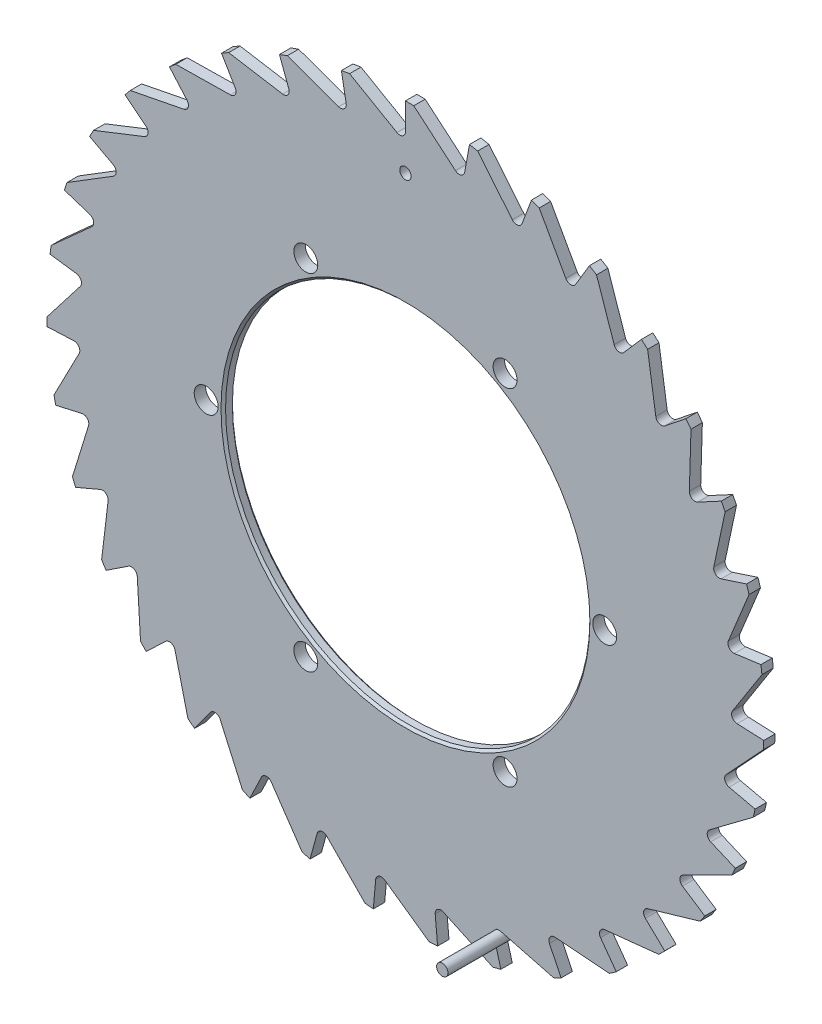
SolidWorks part; units mm, degrees
ref_plane "Plan de face" through (0, 0, 0) normal (0, 0, 1) x (1, 0, 0)
ref_plane "Plan de dessus" through (0, 0, 0) normal (0, 1, 0) x (1, 0, 0)
ref_plane "Plan de droite" through (0, 0, 0) normal (1, 0, 0) x (0, 0, -1)
sketch "Esquisse1" plane through (0, 0, 0) normal (0, 0, 1) x (1, 0, 0)
  circle A0 centre (0, 0) radius 16
  circle A1 centre (0, 0) radius 31.5
  dimension "D1" = 32
  dimension "D2" = 63
extrude "Extrusion1" add sketch "Esquisse1" along normal blind 1
chamfer "Chanfrein1" distance 0.2 angle 45 2 edges at (16, 0, 0) (16, 0, 1)
sketch "Esquisse4" plane through (0, 0, 1) normal (0, 0, 1) x (1, 0, 0)
  line L0 (0, 36.2291) -> (0, 29.15)
  line L1 (-0.75, 28.717) -> (-13.7613, 36.2291)
  line L2 (-13.7613, 36.2291) -> (0, 36.2291)
  arc A0 (0, 29.15) -> (-0.75, 28.717) centre (-0.5, 29.15) cw
  dimension "D1" = 0.5
  dimension "D2" = 60
  dimension "D3" = 29.15
extrude "Enlèv. mat.-Extru.1" cut sketch "Esquisse4" against normal through all
pattern_circular "Répétition circulaire1" count 35 over 360 about axis through (0, 0, 0) along (0, 0, 1) of "Enlèv. mat.-Extru.1"
hole_wizard "Diamètre du perçage M2.1 (2.1)1" positions "Esquisse7" profile "Esquisse6" hole size "M2.1" standard "Ansi Métrique"
sketch "Esquisse7" plane through (0, 0, 1) normal (0, 0, 1) x (1, 0, 0)
  line L1 (0, 0) -> (-38.3683, 0) construction
  circle A0 centre (0, 0) radius 16.2 construction
  point P0 (-17.5, 0)
  dimension "D1" = 17.5
sketch "Esquisse6" plane through (-17.5, 0, 1) normal (1, 0, 0) x (0, -1, 0)
  line L0 (0, 0) -> (0, 1)
  line L1 (0, 1) -> (1.05, 1)
  line L2 (1.05, 1) -> (1.05, 0)
  line L5 (1.05, 0) -> (0, 0)
  line L11 (0, -6.35) -> (0, 107.95) construction
  dimension "Diamètre du perçage jusqu'au prochain" = 2.1
  dimension "Profondeur du perçage jusqu'au prochain" = 1
pattern_circular "Répétition circulaire2" count 6 over 360 about axis through (0, 0, 0) along (0, 0, 1) of "Diamètre du perçage M2.1 (2.1)1"
sketch "Esquisse8" plane through (0, 0, 1) normal (0, 0, 1) x (1, 0, 0)
  circle A0 centre (0, 0) radius 22.3639
sketch "Esquisse10" plane through (0, 0, 1) normal (0, 0, 1) x (1, 0, 0)
  line L0 (0, 29.15) -> (0, 31.5) construction
  circle A0 centre (0, 26) radius 0.5
  circle A1 centre (0, 0) radius 16.2 construction
  dimension "D1" = 1
  dimension "D2" = 26
extrude "Enlèv. mat.-Extru.2" cut sketch "Esquisse10" against normal through all
sketch "Esquisse14" plane through (0, 0, 1) normal (0, 0, 1) x (1, 0, 0)
  circle A0 centre (8.237, -27.9665) radius 0.5
  arc A1 (8.3627, -27.4826) -> (7.755, -28.0995) centre (8.237, -27.9665) ccw construction
  dimension "D1" = 1
extrude "composantD1mm" add sketch "Esquisse14" along normal blind 5 and the other way blind 20
sketch "Esquisse17" plane through (0, 0, 1) normal (0, 0, 1) x (1, 0, 0)
  line L0 (8.585, -28.3255) -> (8.5231, -28.4178)
  line L1 (8.5231, -28.4178) -> (7.9799, -27.4869)
  line L2 (8.0957, -27.4869) -> (8.585, -28.3255)
  line L3 (7.9799, -27.4869) -> (8.0957, -27.4869)
  circle A0 centre (8.237, -27.9665) radius 0.5 construction
  dimension "D1" = 0.1
extrude "Enlèv. mat.-Extru.6" cut sketch "Esquisse17" against normal blind 1
